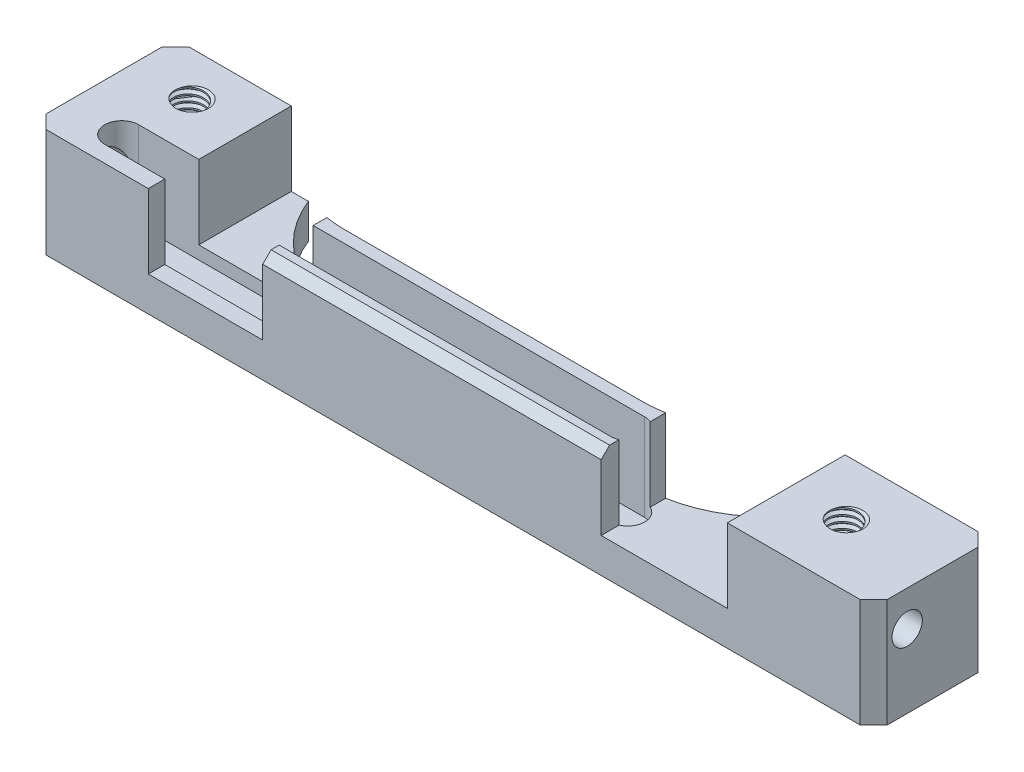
SolidWorks part; units mm, degrees
ref_plane "Front Plane" through (0, 0, 0) normal (0, 0, 1) x (1, 0, 0)
ref_plane "Top Plane" through (0, 0, 0) normal (0, 1, 0) x (1, 0, 0)
ref_plane "Right Plane" through (0, 0, 0) normal (1, 0, 0) x (0, 0, -1)
sketch "Sketch1" plane through (0, 0, 0) normal (0, 1, 0) x (1, 0, 0)
  line L0 (0, 14.2162) -> (0, 0) construction
  line L1 (-35.2552, 0) -> (35.2552, 0) construction
  line L2 (30.099, 0) -> (-31.369, 0)
  line L3 (-32.385, 1.016) -> (-32.385, 9.779)
  line L4 (-31.369, 10.795) -> (-22.352, 10.795)
  line L5 (-13.4755, 4.7244) -> (8.8898, 4.7244)
  line L6 (31.115, 1.016) -> (31.115, 7.874)
  line L7 (30.099, 8.89) -> (16.764, 8.89)
  line L8 (-32.385, 9.779) -> (-31.369, 10.795)
  line L9 (-31.369, 0) -> (-32.385, 1.016)
  line L10 (31.115, 1.016) -> (30.099, 0)
  line L11 (31.115, 7.874) -> (30.099, 8.89)
  arc A0 (-22.352, 10.795) -> (-13.4755, 4.7244) centre (-13.4755, 14.2494) ccw
  arc A1 (16.764, 8.89) -> (8.8898, 4.7244) centre (8.8898, 14.2494) cw
  circle A2 centre (-27.9654, 7.4422) radius 1.1176
  circle A3 centre (24.2316, 4.6482) radius 1.1176
  point P5 (31.115, 0)
  point P6 (-32.385, 0)
  point P8 (-32.385, 10.795)
  point P14 (31.115, 8.89)
  dimension "D9" = 9.525
  dimension "D10" = 9.525
  dimension "D11" = 2.2352
  dimension "D18" = 2.2352
  dimension "D2" = 32.385
  dimension "D3" = 10.795
  dimension "D4" = 10.033
  dimension "D5" = 4.7244
  dimension "D6" = 63.5
  dimension "D7" = 8.89
  dimension "D8" = 39.116
  dimension "D12" = 7.4422
  dimension "D17" = 4.6482
  dimension "D19" = 52.197
  dimension "D20" = 4.4196
extrude "Boss-Extrude1" add sketch "Sketch1" against normal blind 8.2042
sketch "Sketch2" plane through (0, 0, 0) normal (0, 1, 0) x (1, 0, 0)
  line L0 (-31.369, 0) -> (30.099, 0) construction
  line L1 (-23.6474, 0) -> (-15.0114, 0)
  line L2 (-23.6474, 0) -> (-23.6474, 10.795)
  line L3 (-23.6474, 10.795) -> (-15.0114, 10.795)
  line L4 (-15.0114, 0) -> (-15.0114, 10.795)
  line L5 (-32.385, 9.779) -> (-32.385, 1.016) construction
  line L6 (-22.352, 10.795) -> (-31.369, 10.795) construction
  line L7 (30.099, 8.89) -> (16.764, 8.89) construction
  line L8 (20.066, 0) -> (10.541, 0)
  line L9 (20.066, 0) -> (20.066, 8.89)
  line L10 (20.066, 8.89) -> (10.541, 8.89)
  line L11 (10.541, 0) -> (10.541, 8.89)
  dimension "D1" = 8.7376
  dimension "D2" = 8.636
  dimension "D3" = 43.7134
  dimension "D4" = 9.525
extrude "Cut-Extrude1" cut sketch "Sketch2" against normal blind 5.588
sketch "Sketch3" plane through (0, 0, 0) normal (0, 1, 0) x (1, 0, 0)
  line L0 (-28.1813, 2.5273) -> (10.0203, 2.5273) construction
  line L1 (-28.1813, 3.81) -> (10.0203, 3.81)
  line L2 (-28.1813, 1.2446) -> (10.0203, 1.2446)
  line L3 (-31.369, 0) -> (-23.6474, 0) construction
  line L4 (-32.385, 9.779) -> (-32.385, 1.016) construction
  arc A0 (-28.1813, 3.81) -> (-28.1813, 1.2446) centre (-28.1813, 2.5273) ccw
  arc A1 (10.0203, 1.2446) -> (10.0203, 3.81) centre (10.0203, 2.5273) ccw
  point P2 (-9.0805, 2.5273)
  point P11 (-29.464, 2.5273)
  point P12 (11.303, 2.5273)
  dimension "D1" = 2.5654
  dimension "D2" = 3.81
  dimension "D3" = 2.921
  dimension "D4" = 40.767
extrude "Cut-Extrude2" cut sketch "Sketch3" against normal blind 6.5786
thread "Thread1" pitch 0.4536 start angle 0, offset 1.27, length 12.7, pitch 0.4536, diameter 2.2352
ref_plane "Plane1" through (-29.083, 1.27, -7.4422) normal (0, 0, 1) x (-1, 0, 0)
sketch "Thread Profile1" plane through (-29.083, 1.27, -7.4422) normal (0, 0, 1) x (-1, 0, 0)
  line L0 (0, 0) -> (0, 0.4536) construction
  line L1 (0, 0) -> (0.2455, 0.1417)
  line L2 (0.2455, 0.1417) -> (0.2455, 0.1984)
  line L3 (0.2455, 0.1984) -> (0, 0.3402)
  line L4 (0.2455, 0.1701) -> (0, 0.1701) construction
  line L11 (0, 0) -> (0, 0.3402)
  point P2 (0, 0)
  dimension "Pitch" = 0.4536
  dimension "Profile_Angle" = 60
  dimension "Profile_Land" = 0.0567
  dimension "Profile_Height" = 0.2455
thread "Thread2" pitch 0.4536 start angle 0, offset 1.27, length 12.7, pitch 0.4536, diameter 2.2352
ref_plane "Plane2" through (23.114, 1.27, -4.6482) normal (0, 0, 1) x (-1, 0, 0)
sketch "Thread Profile2" plane through (23.114, 1.27, -4.6482) normal (0, 0, 1) x (-1, 0, 0)
  line L0 (0, 0) -> (0, 0.4536) construction
  line L1 (0, 0) -> (0.2455, 0.1417)
  line L2 (0.2455, 0.1417) -> (0.2455, 0.1984)
  line L3 (0.2455, 0.1984) -> (0, 0.3402)
  line L4 (0.2455, 0.1701) -> (0, 0.1701) construction
  line L11 (0, 0) -> (0, 0.3402)
  point P2 (0, 0)
  dimension "Pitch" = 0.4536
  dimension "Profile_Angle" = 60
  dimension "Profile_Land" = 0.0567
  dimension "Profile_Height" = 0.2455
sketch "Sketch4" plane through (-32.385, 0, 0) normal (-1, 0, 0) x (0, 0, 1)
  line L0 (-2.5273, -6.5786) -> (-2.5273, 0) construction
  line L1 (-1.2446, -6.5786) -> (-3.81, -6.5786) construction
  line L2 (-9.779, 0) -> (-1.016, 0) construction
  line L4 (-9.779, -8.2042) -> (-1.016, -8.2042) construction
  circle A0 centre (-2.5273, -2.667) radius 1.143
  dimension "D2" = 2.286
  dimension "D1" = 5.5372
extrude "Cut-Extrude3" cut sketch "Sketch4" against normal through all
chamfer "Chamfer1" distance 0.635 angle 45 1 edges at (-2.2352, 0, 0)
